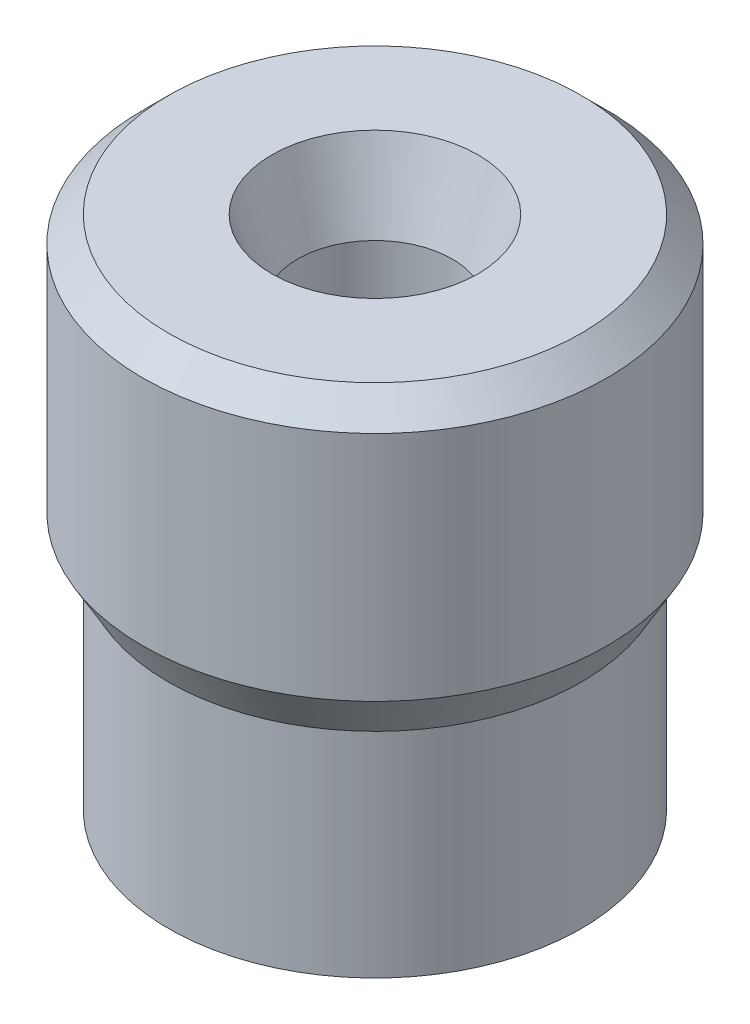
SolidWorks part; units mm, degrees
ref_plane "Přední rovina" through (0, 0, 0) normal (0, 0, 1) x (1, 0, 0)
ref_plane "Horní rovina" through (0, 0, 0) normal (0, 1, 0) x (1, 0, 0)
ref_plane "Pravá rovina" through (0, 0, 0) normal (1, 0, 0) x (0, 0, -1)
sketch "Skica1" plane through (0, 0, 0) normal (0, 1, 0) x (1, 0, 0)
  circle A0 centre (0, 0) radius 8
extrude "Přidat vysunutím1" add sketch "Skica1" along normal blind 8.3
sketch "Skica2" plane through (0, 8.3, 0) normal (0, 1, 0) x (-1, 0, 0)
  circle A0 centre (0, 0) radius 9
extrude "Přidat vysunutím2" add sketch "Skica2" along normal blind 11.7
chamfer "Zkosení1" distance 1.7 angle 30 1 edges at (0, 8.3, 9)
chamfer "Zkosení2" distance 1 angle 45 1 edges at (0, 20, 9)
sketch "Skica3" plane through (0, 0, 0) normal (0, -1, 0) x (1, 0, 0)
  circle A0 centre (0, 0) radius 2
extrude "Odebrat vysunutím1" cut sketch "Skica3" against normal blind 11
sketch "Skica4" plane through (0, 20, 0) normal (0, 1, 0) x (1, 0, 0)
  circle A0 centre (0, 0) radius 3
  dimension "D1" = 6
extrude "Odebrat vysunutím2" cut sketch "Skica4" against normal blind 9
chamfer "Zkosení3" distance 1 distance2 3 1 edges at (0, 20, 3)
